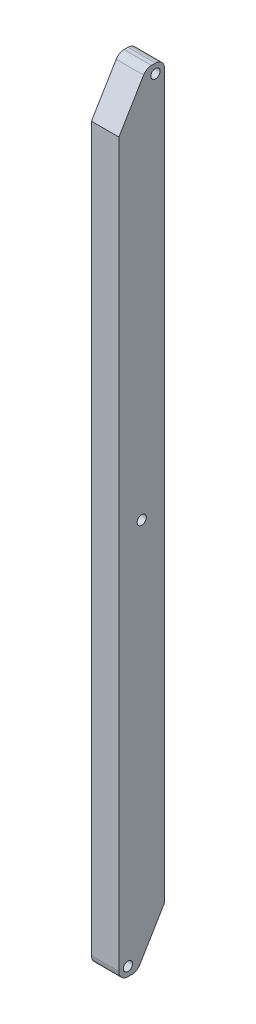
SolidWorks part; units mm, degrees
ref_plane "前视基准面" through (0, 0, 0) normal (0, 0, 1) x (1, 0, 0)
ref_plane "上视基准面" through (0, 0, 0) normal (0, 1, 0) x (1, 0, 0)
ref_plane "右视基准面" through (0, 0, 0) normal (1, 0, 0) x (0, 0, -1)
sketch "草图2" plane through (0, 0, 0) normal (0, 0, 1) x (1, 0, 0)
  line L0 (0, 0) -> (0, 153.8889) construction
  line L1 (0, 0) -> (-277.2222, 0) construction
  line L2 (-560, 30) -> (560, 30)
  line L3 (-560, 30) -> (-560, -30)
  line L4 (-560, -30) -> (560, -30)
  line L5 (560, 30) -> (560, -30)
  line L6 (-560, 30) -> (560, -30) construction
  line L7 (-560, -30) -> (560, 30) construction
  line L8 (-560, 750) -> (-620, 750)
  line L9 (-560, 750) -> (-560, -750)
  line L10 (-560, -750) -> (-620, -750)
  line L11 (-620, 750) -> (-620, -750)
  line L12 (560, -750) -> (620, -750)
  line L13 (560, 750) -> (560, -750)
  line L14 (560, 750) -> (620, 750)
  line L15 (560, 30) -> (560, -30)
  line L16 (620, 750) -> (620, -750)
  dimension "D1" = 60
  dimension "D2" = 1500
  dimension "D3" = 1240
extrude "凸台-拉伸1" add sketch "草图2" along normal mid plane 100 contours L8 L11 L10 L9 L3 | L5 L2 L3 L4 | L16 L14 L13 L5 L12
sketch "草图4" plane through (0, 30, 0) normal (0, 1, 0) x (1, 0, 0)
  line L0 (0, 0) -> (-400, 0) construction
  line L2 (-420, 30) -> (-380, 30)
  line L3 (-420, 30) -> (-420, -30)
  line L4 (-420, -30) -> (-380, -30)
  line L5 (-380, 30) -> (-380, -30)
  line L6 (-420, 30) -> (-380, -30) construction
  line L7 (-420, -30) -> (-380, 30) construction
  dimension "D1" = 40
  dimension "D2" = 60
  dimension "D3" = 400
extrude "凸台-拉伸2" add sketch "草图4" along normal blind 80
sketch "草图5" plane through (-380, 0, 0) normal (1, 0, 0) x (0, 0, -1)
  line L0 (0, 110) -> (0, 90) construction
  line L1 (-30, 110) -> (30, 110) construction
  circle A0 centre (0, 90) radius 10
  dimension "D1" = 20
  dimension "D2" = 20
extrude "切除-拉伸1" cut sketch "草图5" against normal blind 80
fillet "圆角1" radius 30 2 edges at (-400, 110, -30) (-400, 110, 30)
sketch "草图6" plane through (0, 0, 30) normal (0, 0, 1) x (1, 0, 0)
  line L0 (-400, 110) -> (-400, 13.3706) construction
  line L1 (-420, 110) -> (-380, 110) construction
  line L2 (-560, 30) -> (560, 30) construction
  line L3 (-410, 110) -> (-390, 110)
  line L4 (-410, 110) -> (-410, 30)
  line L5 (-410, 30) -> (-390, 30)
  line L6 (-390, 110) -> (-390, 30)
  line L7 (-410, 110) -> (-390, 30) construction
  line L8 (-410, 30) -> (-390, 110) construction
  point P4 (-400, 70)
  dimension "D1" = 20
extrude "切除-拉伸2" cut sketch "草图6" against normal blind 80
sketch "草图7" plane through (-560, 0, 0) normal (1, 0, 0) x (0, 0, -1)
  line L0 (-50, 750) -> (10, 850)
  line L1 (10, 850) -> (50, 850)
  line L2 (50, 850) -> (50, 750)
  line L3 (50, 750) -> (-50, 750)
  line L4 (30, 850) -> (30, 830) construction
  line L5 (-50, -750) -> (-50, -850)
  line L6 (-50, 750) -> (-50, -750) construction
  line L7 (-50, -850) -> (-10, -850)
  line L8 (-10, -850) -> (50, -750)
  line L9 (50, 750) -> (50, -750) construction
  line L10 (50, -750) -> (-50, -750)
  line L11 (-30, -850) -> (-30, -830) construction
  line L12 (-50, -750) -> (50, -750) construction
  circle A0 centre (30, 830) radius 10
  circle A1 centre (-30, -830) radius 10
  point P22 (0, -750)
  dimension "D1" = 20
  dimension "D2" = 100
  dimension "D3" = 40
  dimension "D4" = 20
extrude "凸台-拉伸3" add sketch "草图7" against normal blind 60
fillet "圆角2" radius 20 4 edges at (-590, 850, -10) (-590, 850, -50) (-590, -850, 10) (-590, -850, 50)
mirror "镜向1" about plane through (0, 0, 0) normal (1, 0, 0) of "圆角2", "凸台-拉伸3", "切除-拉伸2", "圆角1", "切除-拉伸1", "凸台-拉伸2"
sketch "草图8" plane through (0, 0, 0) normal (1, 0, 0) x (0, 0, -1)
  circle A0 centre (0, 0) radius 10
  dimension "D1" = 20
extrude "切除-拉伸3" cut sketch "草图8" against normal mid plane 1500
sketch "草图9" plane through (0, 0, 50) normal (0, 0, 1) x (1, 0, 0)
  line L0 (560, 750) -> (560, 30) construction
  line L1 (560, 1113.5507) -> (-1375.3017, 1113.5507)
  line L2 (560, 1113.5507) -> (560, -1091.3684)
  line L3 (560, -1091.3684) -> (-1375.3017, -1091.3684)
  line L4 (-1375.3017, 1113.5507) -> (-1375.3017, -1091.3684)
extrude "切除-拉伸4" cut sketch "草图9" against normal blind 1500
sketch "草图10" plane through (560, 0, 0) normal (-1, 0, 0) x (0, 0, 1)
  line L4 (-50, -750) -> (4.1739, -840.2899)
  line L5 (21.3238, -850) -> (30, -850)
  line L6 (50, -830) -> (50, 750)
  line L7 (50, 750) -> (-4.1739, 840.2899)
  line L8 (-50, -750) -> (4.1739, -840.2899)
  line L9 (21.3238, -850) -> (30, -850)
  line L10 (50, -830) -> (50, 750)
  line L11 (50, 750) -> (-4.1739, 840.2899)
  line L14 (-21.3238, 850) -> (-30, 850)
  line L15 (-21.3238, 850) -> (-30, 850)
  line L16 (-50, 830) -> (-50, -750)
  line L17 (-50, 830) -> (-50, -750)
  circle A0 centre (30, -830) radius 10 construction
  circle A1 centre (30, -830) radius 10
  arc A2 (4.1739, -840.2899) -> (21.3238, -850) centre (21.3238, -830) ccw
  arc A3 (30, -850) -> (50, -830) centre (30, -830) ccw
  arc A4 (4.1739, -840.2899) -> (21.3238, -850) centre (21.3238, -830) ccw
  arc A5 (30, -850) -> (50, -830) centre (30, -830) ccw
  circle A6 centre (-30, 830) radius 10 construction
  circle A7 centre (-30, 830) radius 10
  circle A8 centre (0, 0) radius 10 construction
  circle A9 centre (0, 0) radius 10
  arc A10 (-4.1739, 840.2899) -> (-21.3238, 850) centre (-21.3238, 830) ccw
  arc A11 (-4.1739, 840.2899) -> (-21.3238, 850) centre (-21.3238, 830) ccw
  arc A12 (-30, 850) -> (-50, 830) centre (-30, 830) ccw
  arc A13 (-30, 850) -> (-50, 830) centre (-30, 830) ccw
  dimension "D1" = 0
extrude "凸台-拉伸4" add sketch "草图10" against normal blind 60
